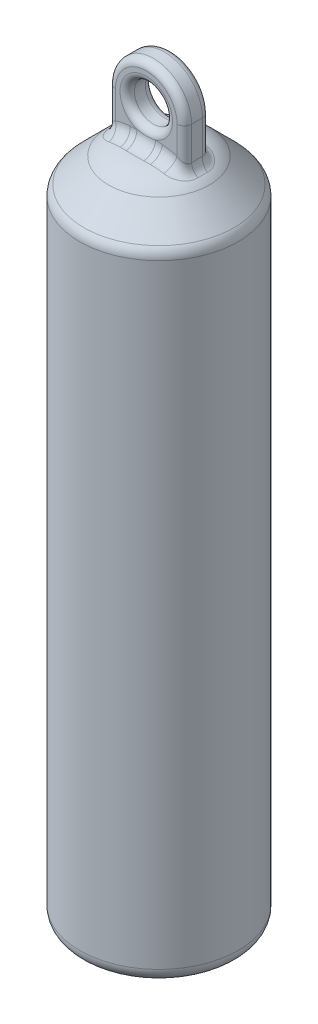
SolidWorks part; units mm, degrees
ref_plane "Спереди" through (0, 0, 0) normal (0, 0, 1) x (1, 0, 0)
ref_plane "Сверху" through (0, 0, 0) normal (0, 1, 0) x (1, 0, 0)
ref_plane "Справа" through (0, 0, 0) normal (1, 0, 0) x (0, 0, -1)
sketch "Эскиз1" plane through (0, 0, 0) normal (0, 0, 1) x (1, 0, 0)
  line L0 (0, 0) -> (-6.15, 0)
  line L1 (-7.5, 1.35) -> (-7.5, 59.4408)
  line L2 (-7.1046, 60.3954) -> (-3.6, 63.9)
  line L3 (-3.6, 63.9) -> (0, 63.9)
  line L4 (0, 63.9) -> (0, 0)
  arc A0 (-7.5, 59.4408) -> (-7.1046, 60.3954) centre (-6.15, 59.4408) cw
  arc A1 (-6.15, 0) -> (-7.5, 1.35) centre (-6.15, 1.35) cw
  point P8 (-7.5, 60)
  point P11 (-7.5, 0)
  dimension "D5" = 1.35
  dimension "D1" = 7.5
  dimension "D2" = 60
  dimension "D3" = 45
  dimension "D4" = 3.6
revolve "Повернуть1" add sketch "Эскиз1" angle 360 about L4
fillet "Скругление1" radius 4 1 edges at (-3.6, 63.9, 0)
sketch "Эскиз2" plane through (0, 0, 0) normal (0, 0, 1) x (1, 0, 0)
  line L0 (-3.6, 67.385) -> (-3.6, 62.385)
  line L1 (-3.6, 62.385) -> (3.6, 62.385)
  line L2 (3.6, 62.385) -> (3.6, 67.385)
  circle A0 centre (0, 67.385) radius 1.8
  arc A1 (3.6, 67.385) -> (-3.6, 67.385) centre (0, 67.385) ccw
  dimension "D1" = 3.6
  dimension "D2" = 7.2
  dimension "D3" = 5
  dimension "D4" = 67.385
extrude "Бобышка-Вытянуть1" add sketch "Эскиз2" along normal mid plane 2.4
fillet "Скругление2" radius 0.685 8 edges at (-3.6, 65.4153, -1.2) (0, 70.985, -1.2) (-3.6, 65.4153, 1.2) (0, 70.985, 1.2) (1.8, 67.385, -1.2) (1.8, 67.385, 1.2) (3.6, 65.4153, -1.2) (3.6, 65.4153, 1.2)
fillet "Скругление3" radius 1.2 12 edges at (0, 63.9, -1.2) (0, 63.9, 1.2) (3.4674, 63.5464, 0.9201) (3.6, 56.3546, 1.2018) (3.3579, 63.5784, -1.0375) (-3.4674, 63.5464, -0.9201) (-3.6, 56.3546, -1.2018) (-3.3579, 63.5784, 1.0375)
